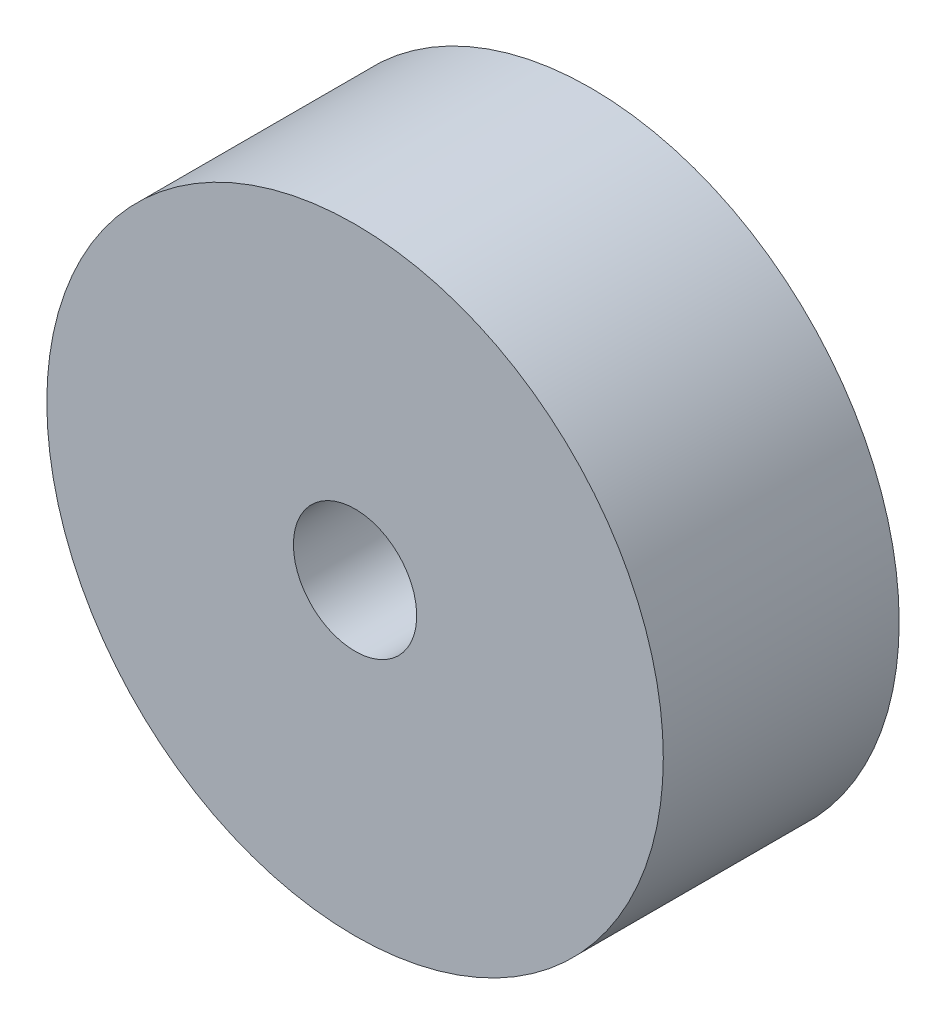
SolidWorks part; units mm, degrees
ref_plane "midplane" through (0, 0, 0) normal (0, 0, 1) x (1, 0, 0)
ref_plane "Top Plane" through (0, 0, 0) normal (0, 1, 0) x (1, 0, 0)
ref_plane "Right Plane" through (0, 0, 0) normal (1, 0, 0) x (0, 0, -1)
ref_axis "wheel_axis" through (0, 0, -88.99) along (0, 0, 1)
sketch "Sketch3" plane through (0, 0, 0) normal (1, 0, 0) x (0, 0, -1)
  line L0 (0, 55) -> (0, -55) construction
  line L1 (11, 8) -> (-11, 8)
  line L2 (11, 8) -> (11, 31)
  line L3 (11, 31) -> (-11, 31)
  line L4 (-11, 8) -> (-11, 31)
  line L5 (11, 8) -> (-11, 31) construction
  line L6 (11, 31) -> (-11, 8) construction
  line L7 (88.99, 0) -> (-88.99, 0) construction
  line L8 (12.4348, 6.5) -> (-12.4348, 6.5)
  line L9 (12.4348, 6.5) -> (12.4348, 32.5)
  line L10 (12.4348, 32.5) -> (-12.4348, 32.5)
  line L11 (-12.4348, 6.5) -> (-12.4348, 32.5)
  line L12 (12.4348, 6.5) -> (-12.4348, 32.5) construction
  line L13 (12.4348, 32.5) -> (-12.4348, 6.5) construction
  point P0 (0, 19.5)
  point P7 (0, 19.5)
  dimension "D1" = 31
  dimension "D2" = 8
  dimension "D3" = 26
  dimension "D4" = 22
revolve "Revolve1" add sketch "Sketch3" angle 360 about axis through (0, 0, -88.99) along (0, 0, 1)
